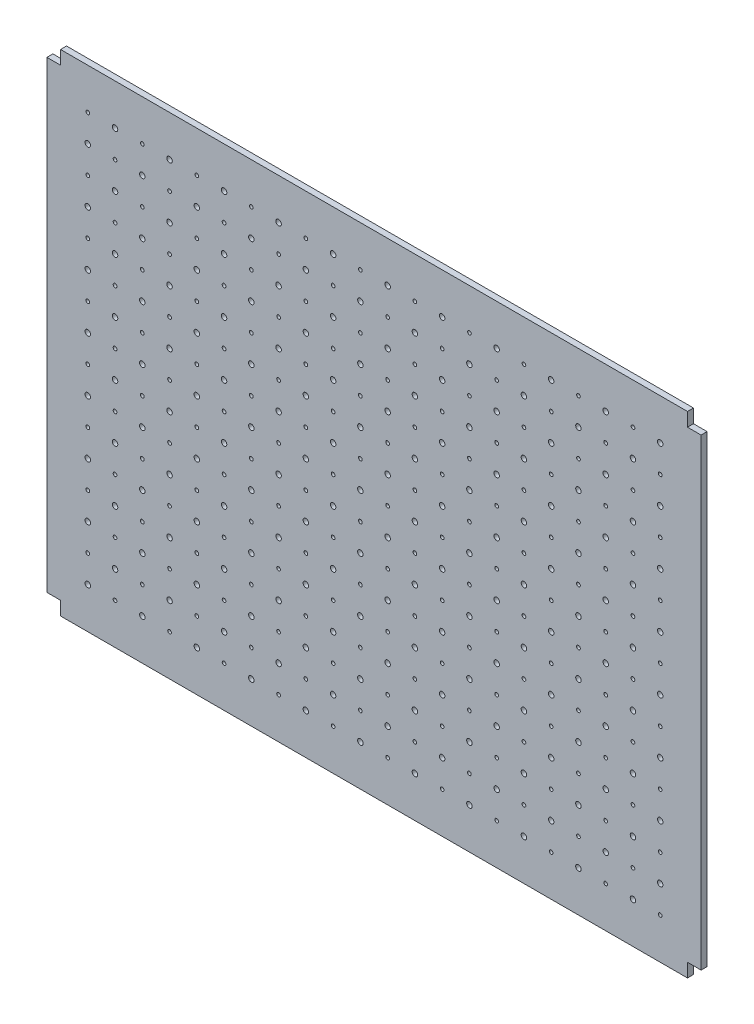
SolidWorks part; units mm, degrees
ref_plane "Front Plane" through (0, 0, 0) normal (0, 0, 1) x (1, 0, 0)
ref_plane "Top Plane" through (0, 0, 0) normal (0, 1, 0) x (1, 0, 0)
ref_plane "Right Plane" through (0, 0, 0) normal (1, 0, 0) x (0, 0, -1)
sketch "Sketch1" plane through (0, 0, 0) normal (0, 0, 1) x (1, 0, 0)
  line L1 (-304.8, -228.6) -> (304.8, -228.6)
  line L2 (-304.8, -228.6) -> (-304.8, 228.6)
  line L3 (-304.8, 228.6) -> (304.8, 228.6)
  line L4 (304.8, -228.6) -> (304.8, 228.6)
  line L5 (-304.8, -228.6) -> (304.8, 228.6) construction
  line L6 (-304.8, 228.6) -> (304.8, -228.6) construction
  point P0 (0, 0)
  dimension "D1" = 457.2
  dimension "D2" = 609.6
extrude "Boss-Extrude1" add sketch "Sketch1" along normal mid plane 5.588
sketch "Sketch2" plane through (0, 0, 0) normal (0, 0, 1) x (1, 0, 0)
  line L1 (-304.8, 228.6) -> (-292.1, 228.6)
  line L2 (-304.8, 228.6) -> (-304.8, 215.9)
  line L3 (-304.8, 215.9) -> (-292.1, 215.9)
  line L4 (-292.1, 228.6) -> (-292.1, 215.9)
  line L5 (304.8, 228.6) -> (292.1, 228.6)
  line L6 (304.8, 228.6) -> (304.8, 215.9)
  line L7 (304.8, 215.9) -> (292.1, 215.9)
  line L8 (292.1, 228.6) -> (292.1, 215.9)
  line L9 (304.8, -228.6) -> (292.1, -228.6)
  line L10 (304.8, -228.6) -> (304.8, -215.9)
  line L11 (304.8, -215.9) -> (292.1, -215.9)
  line L12 (292.1, -228.6) -> (292.1, -215.9)
  line L13 (-304.8, -228.6) -> (-292.1, -228.6)
  line L14 (-304.8, -228.6) -> (-304.8, -215.9)
  line L15 (-304.8, -215.9) -> (-292.1, -215.9)
  line L16 (-292.1, -228.6) -> (-292.1, -215.9)
  dimension "D1" = 12.7
extrude "Cut-Extrude1" cut sketch "Sketch2" against normal through all and the other way through all
hole_wizard "1/4-20 Tapped Hole1" positions "Sketch5" profile "Sketch4" tap size "1/4-20" standard "ANSI Inch"
sketch "Sketch5" plane through (0, 0, 2.794) normal (0, 0, 1) x (1, 0, 0)
  point P0 (-266.7, -190.5)
  point P187 (-241.3, -190.5)
  point P188 (-215.9, -190.5)
  point P189 (-190.5, -190.5)
  point P190 (-165.1, -190.5)
  point P191 (-139.7, -190.5)
  point P192 (-114.3, -190.5)
  point P193 (-88.9, -190.5)
  point P194 (-63.5, -190.5)
  point P195 (-38.1, -190.5)
  point P196 (-12.7, -190.5)
  point P197 (12.7, -190.5)
  point P198 (38.1, -190.5)
  point P199 (63.5, -190.5)
  point P200 (88.9, -190.5)
  point P201 (114.3, -190.5)
  point P202 (139.7, -190.5)
  point P203 (165.1, -190.5)
  point P204 (190.5, -190.5)
  point P205 (215.9, -190.5)
  point P206 (241.3, -190.5)
  point P207 (266.7, -190.5)
  point P208 (-241.3, -165.1)
  point P209 (-215.9, -165.1)
  point P210 (-190.5, -165.1)
  point P211 (-165.1, -165.1)
  point P212 (-139.7, -165.1)
  point P213 (-114.3, -165.1)
  point P214 (-88.9, -165.1)
  point P215 (-63.5, -165.1)
  point P216 (-38.1, -165.1)
  point P217 (-12.7, -165.1)
  point P218 (12.7, -165.1)
  point P219 (38.1, -165.1)
  point P220 (63.5, -165.1)
  point P221 (88.9, -165.1)
  point P222 (114.3, -165.1)
  point P223 (139.7, -165.1)
  point P224 (165.1, -165.1)
  point P225 (190.5, -165.1)
  point P226 (215.9, -165.1)
  point P227 (241.3, -165.1)
  point P228 (266.7, -165.1)
  point P229 (-241.3, -139.7)
  point P230 (-215.9, -139.7)
  point P231 (-190.5, -139.7)
  point P232 (-165.1, -139.7)
  point P233 (-139.7, -139.7)
  point P234 (-114.3, -139.7)
  point P235 (-88.9, -139.7)
  point P236 (-63.5, -139.7)
  point P237 (-38.1, -139.7)
  point P238 (-12.7, -139.7)
  point P239 (12.7, -139.7)
  point P240 (38.1, -139.7)
  point P241 (63.5, -139.7)
  point P242 (88.9, -139.7)
  point P243 (114.3, -139.7)
  point P244 (139.7, -139.7)
  point P245 (165.1, -139.7)
  point P246 (190.5, -139.7)
  point P247 (215.9, -139.7)
  point P248 (241.3, -139.7)
  point P249 (266.7, -139.7)
  point P250 (-241.3, -114.3)
  point P251 (-215.9, -114.3)
  point P252 (-190.5, -114.3)
  point P253 (-165.1, -114.3)
  point P254 (-139.7, -114.3)
  point P255 (-114.3, -114.3)
  point P256 (-88.9, -114.3)
  point P257 (-63.5, -114.3)
  point P258 (-38.1, -114.3)
  point P259 (-12.7, -114.3)
  point P260 (12.7, -114.3)
  point P261 (38.1, -114.3)
  point P262 (63.5, -114.3)
  point P263 (88.9, -114.3)
  point P264 (114.3, -114.3)
  point P265 (139.7, -114.3)
  point P266 (165.1, -114.3)
  point P267 (190.5, -114.3)
  point P268 (215.9, -114.3)
  point P269 (241.3, -114.3)
  point P270 (266.7, -114.3)
  point P271 (-241.3, -88.9)
  point P272 (-215.9, -88.9)
  point P273 (-190.5, -88.9)
  point P274 (-165.1, -88.9)
  point P275 (-139.7, -88.9)
  point P276 (-114.3, -88.9)
  point P277 (-88.9, -88.9)
  point P278 (-63.5, -88.9)
  point P279 (-38.1, -88.9)
  point P280 (-12.7, -88.9)
  point P281 (12.7, -88.9)
  point P282 (38.1, -88.9)
  point P283 (63.5, -88.9)
  point P284 (88.9, -88.9)
  point P285 (114.3, -88.9)
  point P286 (139.7, -88.9)
  point P287 (165.1, -88.9)
  point P288 (190.5, -88.9)
  point P289 (215.9, -88.9)
  point P290 (241.3, -88.9)
  point P291 (266.7, -88.9)
  point P292 (-241.3, -63.5)
  point P293 (-215.9, -63.5)
  point P294 (-190.5, -63.5)
  point P295 (-165.1, -63.5)
  point P296 (-139.7, -63.5)
  point P297 (-114.3, -63.5)
  point P298 (-88.9, -63.5)
  point P299 (-63.5, -63.5)
  point P300 (-38.1, -63.5)
  point P301 (-12.7, -63.5)
  point P302 (12.7, -63.5)
  point P303 (38.1, -63.5)
  point P304 (63.5, -63.5)
  point P305 (88.9, -63.5)
  point P306 (114.3, -63.5)
  point P307 (139.7, -63.5)
  point P308 (165.1, -63.5)
  point P309 (190.5, -63.5)
  point P310 (215.9, -63.5)
  point P311 (241.3, -63.5)
  point P312 (266.7, -63.5)
  point P313 (-241.3, -38.1)
  point P314 (-215.9, -38.1)
  point P315 (-190.5, -38.1)
  point P316 (-165.1, -38.1)
  point P317 (-139.7, -38.1)
  point P318 (-114.3, -38.1)
  point P319 (-88.9, -38.1)
  point P320 (-63.5, -38.1)
  point P321 (-38.1, -38.1)
  point P322 (-12.7, -38.1)
  point P323 (12.7, -38.1)
  point P324 (38.1, -38.1)
  point P325 (63.5, -38.1)
  point P326 (88.9, -38.1)
  point P327 (114.3, -38.1)
  point P328 (139.7, -38.1)
  point P329 (165.1, -38.1)
  point P330 (190.5, -38.1)
  point P331 (215.9, -38.1)
  point P332 (241.3, -38.1)
  point P333 (266.7, -38.1)
  point P334 (-241.3, -12.7)
  point P335 (-215.9, -12.7)
  point P336 (-190.5, -12.7)
  point P337 (-165.1, -12.7)
  point P338 (-139.7, -12.7)
  point P339 (-114.3, -12.7)
  point P340 (-88.9, -12.7)
  point P341 (-63.5, -12.7)
  point P342 (-38.1, -12.7)
  point P343 (-12.7, -12.7)
  point P344 (12.7, -12.7)
  point P345 (38.1, -12.7)
  point P346 (63.5, -12.7)
  point P347 (88.9, -12.7)
  point P348 (114.3, -12.7)
  point P349 (139.7, -12.7)
  point P350 (165.1, -12.7)
  point P351 (190.5, -12.7)
  point P352 (215.9, -12.7)
  point P353 (241.3, -12.7)
  point P354 (266.7, -12.7)
  point P355 (-241.3, 12.7)
  point P356 (-215.9, 12.7)
  point P357 (-190.5, 12.7)
  point P358 (-165.1, 12.7)
  point P359 (-139.7, 12.7)
  point P360 (-114.3, 12.7)
  point P361 (-88.9, 12.7)
  point P362 (-63.5, 12.7)
  point P363 (-38.1, 12.7)
  point P364 (-12.7, 12.7)
  point P365 (12.7, 12.7)
  point P366 (38.1, 12.7)
  point P367 (63.5, 12.7)
  point P368 (88.9, 12.7)
  point P369 (114.3, 12.7)
  point P370 (139.7, 12.7)
  point P371 (165.1, 12.7)
  point P372 (190.5, 12.7)
  point P373 (215.9, 12.7)
  point P374 (241.3, 12.7)
  point P375 (266.7, 12.7)
  point P376 (-241.3, 38.1)
  point P377 (-215.9, 38.1)
  point P378 (-190.5, 38.1)
  point P379 (-165.1, 38.1)
  point P380 (-139.7, 38.1)
  point P381 (-114.3, 38.1)
  point P382 (-88.9, 38.1)
  point P383 (-63.5, 38.1)
  point P384 (-38.1, 38.1)
  point P385 (-12.7, 38.1)
  point P386 (12.7, 38.1)
  point P387 (38.1, 38.1)
  point P388 (63.5, 38.1)
  point P389 (88.9, 38.1)
  point P390 (114.3, 38.1)
  point P391 (139.7, 38.1)
  point P392 (165.1, 38.1)
  point P393 (190.5, 38.1)
  point P394 (215.9, 38.1)
  point P395 (241.3, 38.1)
  point P396 (266.7, 38.1)
  point P397 (-241.3, 63.5)
  point P398 (-215.9, 63.5)
  point P399 (-190.5, 63.5)
  point P400 (-165.1, 63.5)
  point P401 (-139.7, 63.5)
  point P402 (-114.3, 63.5)
  point P403 (-88.9, 63.5)
  point P404 (-63.5, 63.5)
  point P405 (-38.1, 63.5)
  point P406 (-12.7, 63.5)
  point P407 (12.7, 63.5)
  point P408 (38.1, 63.5)
  point P409 (63.5, 63.5)
  point P410 (88.9, 63.5)
  point P411 (114.3, 63.5)
  point P412 (139.7, 63.5)
  point P413 (165.1, 63.5)
  point P414 (190.5, 63.5)
  point P415 (215.9, 63.5)
  point P416 (241.3, 63.5)
  point P417 (266.7, 63.5)
  point P418 (-241.3, 88.9)
  point P419 (-215.9, 88.9)
  point P420 (-190.5, 88.9)
  point P421 (-165.1, 88.9)
  point P422 (-139.7, 88.9)
  point P423 (-114.3, 88.9)
  point P424 (-88.9, 88.9)
  point P425 (-63.5, 88.9)
  point P426 (-38.1, 88.9)
  point P427 (-12.7, 88.9)
  point P428 (12.7, 88.9)
  point P429 (38.1, 88.9)
  point P430 (63.5, 88.9)
  point P431 (88.9, 88.9)
  point P432 (114.3, 88.9)
  point P433 (139.7, 88.9)
  point P434 (165.1, 88.9)
  point P435 (190.5, 88.9)
  point P436 (215.9, 88.9)
  point P437 (241.3, 88.9)
  point P438 (266.7, 88.9)
  point P439 (-241.3, 114.3)
  point P440 (-215.9, 114.3)
  point P441 (-190.5, 114.3)
  point P442 (-165.1, 114.3)
  point P443 (-139.7, 114.3)
  point P444 (-114.3, 114.3)
  point P445 (-88.9, 114.3)
  point P446 (-63.5, 114.3)
  point P447 (-38.1, 114.3)
  point P448 (-12.7, 114.3)
  point P449 (12.7, 114.3)
  point P450 (38.1, 114.3)
  point P451 (63.5, 114.3)
  point P452 (88.9, 114.3)
  point P453 (114.3, 114.3)
  point P454 (139.7, 114.3)
  point P455 (165.1, 114.3)
  point P456 (190.5, 114.3)
  point P457 (215.9, 114.3)
  point P458 (241.3, 114.3)
  point P459 (266.7, 114.3)
  point P460 (-241.3, 139.7)
  point P461 (-215.9, 139.7)
  point P462 (-190.5, 139.7)
  point P463 (-165.1, 139.7)
  point P464 (-139.7, 139.7)
  point P465 (-114.3, 139.7)
  point P466 (-88.9, 139.7)
  point P467 (-63.5, 139.7)
  point P468 (-38.1, 139.7)
  point P469 (-12.7, 139.7)
  point P470 (12.7, 139.7)
  point P471 (38.1, 139.7)
  point P472 (63.5, 139.7)
  point P473 (88.9, 139.7)
  point P474 (114.3, 139.7)
  point P475 (139.7, 139.7)
  point P476 (165.1, 139.7)
  point P477 (190.5, 139.7)
  point P478 (215.9, 139.7)
  point P479 (241.3, 139.7)
  point P480 (266.7, 139.7)
  point P481 (-241.3, 165.1)
  point P482 (-215.9, 165.1)
  point P483 (-190.5, 165.1)
  point P484 (-165.1, 165.1)
  point P485 (-139.7, 165.1)
  point P486 (-114.3, 165.1)
  point P487 (-88.9, 165.1)
  point P488 (-63.5, 165.1)
  point P489 (-38.1, 165.1)
  point P490 (-12.7, 165.1)
  point P491 (12.7, 165.1)
  point P492 (38.1, 165.1)
  point P493 (63.5, 165.1)
  point P494 (88.9, 165.1)
  point P495 (114.3, 165.1)
  point P496 (139.7, 165.1)
  point P497 (165.1, 165.1)
  point P498 (190.5, 165.1)
  point P499 (215.9, 165.1)
  point P500 (241.3, 165.1)
  point P501 (266.7, 165.1)
  point P502 (-241.3, 190.5)
  point P503 (-215.9, 190.5)
  point P504 (-190.5, 190.5)
  point P505 (-165.1, 190.5)
  point P506 (-139.7, 190.5)
  point P507 (-114.3, 190.5)
  point P508 (-88.9, 190.5)
  point P509 (-63.5, 190.5)
  point P510 (-38.1, 190.5)
  point P511 (-12.7, 190.5)
  point P512 (12.7, 190.5)
  point P513 (38.1, 190.5)
  point P514 (63.5, 190.5)
  point P515 (88.9, 190.5)
  point P516 (114.3, 190.5)
  point P517 (139.7, 190.5)
  point P518 (165.1, 190.5)
  point P519 (190.5, 190.5)
  point P520 (215.9, 190.5)
  point P521 (241.3, 190.5)
  point P522 (266.7, 190.5)
  point P523 (-266.7, -165.1)
  point P524 (-266.7, -139.7)
  point P525 (-266.7, -114.3)
  point P526 (-266.7, -88.9)
  point P527 (-266.7, -63.5)
  point P528 (-266.7, -38.1)
  point P529 (-266.7, -12.7)
  point P530 (-266.7, 12.7)
  point P531 (-266.7, 38.1)
  point P532 (-266.7, 63.5)
  point P533 (-266.7, 88.9)
  point P534 (-266.7, 114.3)
  point P535 (-266.7, 139.7)
  point P536 (-266.7, 165.1)
  point P537 (-266.7, 190.5)
  dimension "D1" = 25.4
  dimension "D2" = 25.4
  dimension "D3" = 22
  dimension "D4" = 16
sketch "Sketch4" plane through (-266.7, -190.5, 2.794) normal (1, 0, 0) x (0, -1, 0)
  line L0 (0, 0) -> (0, 5.588)
  line L1 (0, 5.588) -> (2.5527, 5.588)
  line L2 (2.5527, 5.588) -> (2.5527, 0)
  line L5 (2.5527, 0) -> (0, 0)
  line L11 (0, -6.35) -> (0, 107.95) construction
  dimension "Thread Major Dia." = 5.1054
  dimension "Thru Tap Drill Depth" = 5.588
hole_wizard "#8-32 Tapped Hole1" positions "Sketch7" profile "Sketch6" tap size "#8-32" standard "ANSI Inch"
sketch "Sketch7" plane through (0, 0, 2.794) normal (0, 0, 1) x (1, 0, 0)
  point P0 (-266.7, -190.5)
  point P9 (-241.3, -190.5)
  point P10 (-215.9, -190.5)
  point P11 (-190.5, -190.5)
  point P12 (-165.1, -190.5)
  point P13 (-139.7, -190.5)
  point P14 (-114.3, -190.5)
  point P15 (-88.9, -190.5)
  point P16 (-63.5, -190.5)
  point P17 (-38.1, -190.5)
  point P18 (-12.7, -190.5)
  point P19 (12.7, -190.5)
  point P20 (38.1, -190.5)
  point P21 (63.5, -190.5)
  point P22 (88.9, -190.5)
  point P23 (114.3, -190.5)
  point P24 (139.7, -190.5)
  point P25 (165.1, -190.5)
  point P26 (190.5, -190.5)
  point P27 (215.9, -190.5)
  point P28 (241.3, -190.5)
  point P29 (266.7, -190.5)
  point P30 (-241.3, -165.1)
  point P31 (-215.9, -165.1)
  point P32 (-190.5, -165.1)
  point P33 (-165.1, -165.1)
  point P34 (-139.7, -165.1)
  point P35 (-114.3, -165.1)
  point P36 (-88.9, -165.1)
  point P37 (-63.5, -165.1)
  point P38 (-38.1, -165.1)
  point P39 (-12.7, -165.1)
  point P40 (12.7, -165.1)
  point P41 (38.1, -165.1)
  point P42 (63.5, -165.1)
  point P43 (88.9, -165.1)
  point P44 (114.3, -165.1)
  point P45 (139.7, -165.1)
  point P46 (165.1, -165.1)
  point P47 (190.5, -165.1)
  point P48 (215.9, -165.1)
  point P49 (241.3, -165.1)
  point P50 (266.7, -165.1)
  point P51 (-241.3, -139.7)
  point P52 (-215.9, -139.7)
  point P53 (-190.5, -139.7)
  point P54 (-165.1, -139.7)
  point P55 (-139.7, -139.7)
  point P56 (-114.3, -139.7)
  point P57 (-88.9, -139.7)
  point P58 (-63.5, -139.7)
  point P59 (-38.1, -139.7)
  point P60 (-12.7, -139.7)
  point P61 (12.7, -139.7)
  point P62 (38.1, -139.7)
  point P63 (63.5, -139.7)
  point P64 (88.9, -139.7)
  point P65 (114.3, -139.7)
  point P66 (139.7, -139.7)
  point P67 (165.1, -139.7)
  point P68 (190.5, -139.7)
  point P69 (215.9, -139.7)
  point P70 (241.3, -139.7)
  point P71 (266.7, -139.7)
  point P72 (-241.3, -114.3)
  point P73 (-215.9, -114.3)
  point P74 (-190.5, -114.3)
  point P75 (-165.1, -114.3)
  point P76 (-139.7, -114.3)
  point P77 (-114.3, -114.3)
  point P78 (-88.9, -114.3)
  point P79 (-63.5, -114.3)
  point P80 (-38.1, -114.3)
  point P81 (-12.7, -114.3)
  point P82 (12.7, -114.3)
  point P83 (38.1, -114.3)
  point P84 (63.5, -114.3)
  point P85 (88.9, -114.3)
  point P86 (114.3, -114.3)
  point P87 (139.7, -114.3)
  point P88 (165.1, -114.3)
  point P89 (190.5, -114.3)
  point P90 (215.9, -114.3)
  point P91 (241.3, -114.3)
  point P92 (266.7, -114.3)
  point P93 (-241.3, -88.9)
  point P94 (-215.9, -88.9)
  point P95 (-190.5, -88.9)
  point P96 (-165.1, -88.9)
  point P97 (-139.7, -88.9)
  point P98 (-114.3, -88.9)
  point P99 (-88.9, -88.9)
  point P100 (-63.5, -88.9)
  point P101 (-38.1, -88.9)
  point P102 (-12.7, -88.9)
  point P103 (12.7, -88.9)
  point P104 (38.1, -88.9)
  point P105 (63.5, -88.9)
  point P106 (88.9, -88.9)
  point P107 (114.3, -88.9)
  point P108 (139.7, -88.9)
  point P109 (165.1, -88.9)
  point P110 (190.5, -88.9)
  point P111 (215.9, -88.9)
  point P112 (241.3, -88.9)
  point P113 (266.7, -88.9)
  point P114 (-241.3, -63.5)
  point P115 (-215.9, -63.5)
  point P116 (-190.5, -63.5)
  point P117 (-165.1, -63.5)
  point P118 (-139.7, -63.5)
  point P119 (-114.3, -63.5)
  point P120 (-88.9, -63.5)
  point P121 (-63.5, -63.5)
  point P122 (-38.1, -63.5)
  point P123 (-12.7, -63.5)
  point P124 (12.7, -63.5)
  point P125 (38.1, -63.5)
  point P126 (63.5, -63.5)
  point P127 (88.9, -63.5)
  point P128 (114.3, -63.5)
  point P129 (139.7, -63.5)
  point P130 (165.1, -63.5)
  point P131 (190.5, -63.5)
  point P132 (215.9, -63.5)
  point P133 (241.3, -63.5)
  point P134 (266.7, -63.5)
  point P135 (-241.3, -38.1)
  point P136 (-215.9, -38.1)
  point P137 (-190.5, -38.1)
  point P138 (-165.1, -38.1)
  point P139 (-139.7, -38.1)
  point P140 (-114.3, -38.1)
  point P141 (-88.9, -38.1)
  point P142 (-63.5, -38.1)
  point P143 (-38.1, -38.1)
  point P144 (-12.7, -38.1)
  point P145 (12.7, -38.1)
  point P146 (38.1, -38.1)
  point P147 (63.5, -38.1)
  point P148 (88.9, -38.1)
  point P149 (114.3, -38.1)
  point P150 (139.7, -38.1)
  point P151 (165.1, -38.1)
  point P152 (190.5, -38.1)
  point P153 (215.9, -38.1)
  point P154 (241.3, -38.1)
  point P155 (266.7, -38.1)
  point P156 (-241.3, -12.7)
  point P157 (-215.9, -12.7)
  point P158 (-190.5, -12.7)
  point P159 (-165.1, -12.7)
  point P160 (-139.7, -12.7)
  point P161 (-114.3, -12.7)
  point P162 (-88.9, -12.7)
  point P163 (-63.5, -12.7)
  point P164 (-38.1, -12.7)
  point P165 (-12.7, -12.7)
  point P166 (12.7, -12.7)
  point P167 (38.1, -12.7)
  point P168 (63.5, -12.7)
  point P169 (88.9, -12.7)
  point P170 (114.3, -12.7)
  point P171 (139.7, -12.7)
  point P172 (165.1, -12.7)
  point P173 (190.5, -12.7)
  point P174 (215.9, -12.7)
  point P175 (241.3, -12.7)
  point P176 (266.7, -12.7)
  point P177 (-241.3, 12.7)
  point P178 (-215.9, 12.7)
  point P179 (-190.5, 12.7)
  point P180 (-165.1, 12.7)
  point P181 (-139.7, 12.7)
  point P182 (-114.3, 12.7)
  point P183 (-88.9, 12.7)
  point P184 (-63.5, 12.7)
  point P185 (-38.1, 12.7)
  point P186 (-12.7, 12.7)
  point P187 (12.7, 12.7)
  point P188 (38.1, 12.7)
  point P189 (63.5, 12.7)
  point P190 (88.9, 12.7)
  point P191 (114.3, 12.7)
  point P192 (139.7, 12.7)
  point P193 (165.1, 12.7)
  point P194 (190.5, 12.7)
  point P195 (215.9, 12.7)
  point P196 (241.3, 12.7)
  point P197 (266.7, 12.7)
  point P198 (-241.3, 38.1)
  point P199 (-215.9, 38.1)
  point P200 (-190.5, 38.1)
  point P201 (-165.1, 38.1)
  point P202 (-139.7, 38.1)
  point P203 (-114.3, 38.1)
  point P204 (-88.9, 38.1)
  point P205 (-63.5, 38.1)
  point P206 (-38.1, 38.1)
  point P207 (-12.7, 38.1)
  point P208 (12.7, 38.1)
  point P209 (38.1, 38.1)
  point P210 (63.5, 38.1)
  point P211 (88.9, 38.1)
  point P212 (114.3, 38.1)
  point P213 (139.7, 38.1)
  point P214 (165.1, 38.1)
  point P215 (190.5, 38.1)
  point P216 (215.9, 38.1)
  point P217 (241.3, 38.1)
  point P218 (266.7, 38.1)
  point P219 (-241.3, 63.5)
  point P220 (-215.9, 63.5)
  point P221 (-190.5, 63.5)
  point P222 (-165.1, 63.5)
  point P223 (-139.7, 63.5)
  point P224 (-114.3, 63.5)
  point P225 (-88.9, 63.5)
  point P226 (-63.5, 63.5)
  point P227 (-38.1, 63.5)
  point P228 (-12.7, 63.5)
  point P229 (12.7, 63.5)
  point P230 (38.1, 63.5)
  point P231 (63.5, 63.5)
  point P232 (88.9, 63.5)
  point P233 (114.3, 63.5)
  point P234 (139.7, 63.5)
  point P235 (165.1, 63.5)
  point P236 (190.5, 63.5)
  point P237 (215.9, 63.5)
  point P238 (241.3, 63.5)
  point P239 (266.7, 63.5)
  point P240 (-241.3, 88.9)
  point P241 (-215.9, 88.9)
  point P242 (-190.5, 88.9)
  point P243 (-165.1, 88.9)
  point P244 (-139.7, 88.9)
  point P245 (-114.3, 88.9)
  point P246 (-88.9, 88.9)
  point P247 (-63.5, 88.9)
  point P248 (-38.1, 88.9)
  point P249 (-12.7, 88.9)
  point P250 (12.7, 88.9)
  point P251 (38.1, 88.9)
  point P252 (63.5, 88.9)
  point P253 (88.9, 88.9)
  point P254 (114.3, 88.9)
  point P255 (139.7, 88.9)
  point P256 (165.1, 88.9)
  point P257 (190.5, 88.9)
  point P258 (215.9, 88.9)
  point P259 (241.3, 88.9)
  point P260 (266.7, 88.9)
  point P261 (-241.3, 114.3)
  point P262 (-215.9, 114.3)
  point P263 (-190.5, 114.3)
  point P264 (-165.1, 114.3)
  point P265 (-139.7, 114.3)
  point P266 (-114.3, 114.3)
  point P267 (-88.9, 114.3)
  point P268 (-63.5, 114.3)
  point P269 (-38.1, 114.3)
  point P270 (-12.7, 114.3)
  point P271 (12.7, 114.3)
  point P272 (38.1, 114.3)
  point P273 (63.5, 114.3)
  point P274 (88.9, 114.3)
  point P275 (114.3, 114.3)
  point P276 (139.7, 114.3)
  point P277 (165.1, 114.3)
  point P278 (190.5, 114.3)
  point P279 (215.9, 114.3)
  point P280 (241.3, 114.3)
  point P281 (266.7, 114.3)
  point P282 (-241.3, 139.7)
  point P283 (-215.9, 139.7)
  point P284 (-190.5, 139.7)
  point P285 (-165.1, 139.7)
  point P286 (-139.7, 139.7)
  point P287 (-114.3, 139.7)
  point P288 (-88.9, 139.7)
  point P289 (-63.5, 139.7)
  point P290 (-38.1, 139.7)
  point P291 (-12.7, 139.7)
  point P292 (12.7, 139.7)
  point P293 (38.1, 139.7)
  point P294 (63.5, 139.7)
  point P295 (88.9, 139.7)
  point P296 (114.3, 139.7)
  point P297 (139.7, 139.7)
  point P298 (165.1, 139.7)
  point P299 (190.5, 139.7)
  point P300 (215.9, 139.7)
  point P301 (241.3, 139.7)
  point P302 (266.7, 139.7)
  point P303 (-241.3, 165.1)
  point P304 (-215.9, 165.1)
  point P305 (-190.5, 165.1)
  point P306 (-165.1, 165.1)
  point P307 (-139.7, 165.1)
  point P308 (-114.3, 165.1)
  point P309 (-88.9, 165.1)
  point P310 (-63.5, 165.1)
  point P311 (-38.1, 165.1)
  point P312 (-12.7, 165.1)
  point P313 (12.7, 165.1)
  point P314 (38.1, 165.1)
  point P315 (63.5, 165.1)
  point P316 (88.9, 165.1)
  point P317 (114.3, 165.1)
  point P318 (139.7, 165.1)
  point P319 (165.1, 165.1)
  point P320 (190.5, 165.1)
  point P321 (215.9, 165.1)
  point P322 (241.3, 165.1)
  point P323 (266.7, 165.1)
  point P324 (-241.3, 190.5)
  point P325 (-215.9, 190.5)
  point P326 (-190.5, 190.5)
  point P327 (-165.1, 190.5)
  point P328 (-139.7, 190.5)
  point P329 (-114.3, 190.5)
  point P330 (-88.9, 190.5)
  point P331 (-63.5, 190.5)
  point P332 (-38.1, 190.5)
  point P333 (-12.7, 190.5)
  point P334 (12.7, 190.5)
  point P335 (38.1, 190.5)
  point P336 (63.5, 190.5)
  point P337 (88.9, 190.5)
  point P338 (114.3, 190.5)
  point P339 (139.7, 190.5)
  point P340 (165.1, 190.5)
  point P341 (190.5, 190.5)
  point P342 (215.9, 190.5)
  point P343 (241.3, 190.5)
  point P344 (266.7, 190.5)
  point P345 (-266.7, -165.1)
  point P346 (-266.7, -139.7)
  point P347 (-266.7, -114.3)
  point P348 (-266.7, -88.9)
  point P349 (-266.7, -63.5)
  point P350 (-266.7, -38.1)
  point P351 (-266.7, -12.7)
  point P352 (-266.7, 12.7)
  point P353 (-266.7, 38.1)
  point P354 (-266.7, 63.5)
  point P355 (-266.7, 88.9)
  point P356 (-266.7, 114.3)
  point P357 (-266.7, 139.7)
  point P358 (-266.7, 165.1)
  point P359 (-266.7, 190.5)
  dimension "D1" = 22
  dimension "D2" = 16
sketch "Sketch6" plane through (-266.7, -190.5, 2.794) normal (1, 0, 0) x (0, -1, 0)
  line L0 (0, 0) -> (0, 5.588)
  line L1 (0, 5.588) -> (1.7272, 5.588)
  line L2 (1.7272, 5.588) -> (1.7272, 0)
  line L5 (1.7272, 0) -> (0, 0)
  line L11 (0, -6.35) -> (0, 107.95) construction
  dimension "Thread Major Dia." = 3.4544
  dimension "Thru Tap Drill Depth" = 5.588
